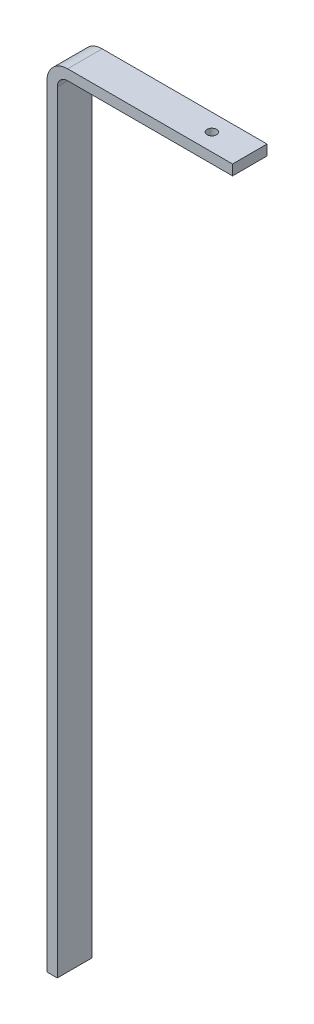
SolidWorks part; units mm, degrees
ref_plane "Plan de face" through (0, 0, 0) normal (0, 0, 1) x (1, 0, 0)
ref_plane "Plan de dessus" through (0, 0, 0) normal (0, 1, 0) x (1, 0, 0)
ref_plane "Plan de droite" through (0, 0, 0) normal (1, 0, 0) x (0, 0, -1)
sketch "Esquisse1" plane through (0, 0, 0) normal (0, 0, 1) x (1, 0, 0)
  line L0 (95.5, 12) -> (0, 12)
  line L1 (-12, 0) -> (-12, -447)
  line L2 (-12, -447) -> (-6, -447)
  line L3 (-6, -447) -> (-6, 0)
  line L4 (0, 6) -> (95.5, 6)
  line L5 (95.5, 12) -> (95.5, 6)
  arc A0 (0, 12) -> (-12, 0) centre (0, 0) ccw
  arc A1 (-6, 0) -> (0, 6) centre (0, 0) cw
  dimension "D3" = 12
  dimension "D4" = 6
  dimension "D1" = 6
  dimension "D2" = 6
  dimension "D5" = 107.5
  dimension "D6" = 459
extrude "Boss.-Extru.1" add sketch "Esquisse1" along normal blind 20
hole_wizard "Dégagement M51" positions "Esquisse3" profile "Esquisse2" hole size "M5" standard "ISO"
sketch "Esquisse3" plane through (0, 12, 0) normal (0, 1, 0) x (-1, 0, 0)
  line L0 (-95.5, 20) -> (-95.5, 0) construction
  line L1 (-95.5, 20) -> (0, 20) construction
  point P0 (-73.5, 10)
  dimension "D1" = 22
  dimension "D2" = 10
sketch "Esquisse2" plane through (73.5, 12, 10) normal (1, 0, 0) x (0, 0, 1)
  line L0 (0, 0) -> (0, 459)
  line L1 (0, 459) -> (2.75, 459)
  line L2 (2.75, 459) -> (2.75, 0)
  line L5 (2.75, 0) -> (0, 0)
  line L11 (0, -6.35) -> (0, 107.95) construction
  dimension "Diamètre du perçage jusqu'au prochain" = 5.5
  dimension "Profondeur du perçage jusqu'au prochain" = 459
